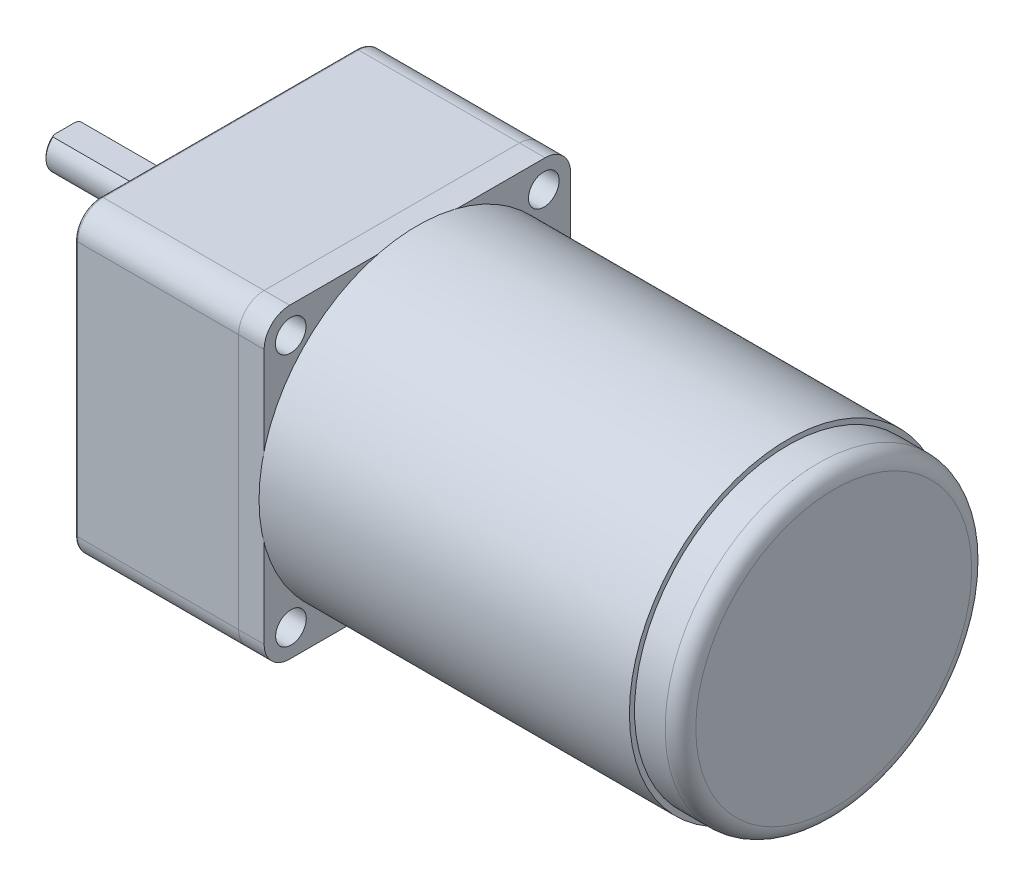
SolidWorks part; units mm, degrees
ref_plane "前视基准面" through (0, 0, 0) normal (0, 0, 1) x (1, 0, 0)
ref_plane "上视基准面" through (0, 0, 0) normal (0, 1, 0) x (1, 0, 0)
ref_plane "右视基准面" through (0, 0, 0) normal (1, 0, 0) x (0, 0, -1)
sketch "草图1" plane through (0, 0, 0) normal (1, 0, 0) x (0, 0, -1)
  line L1 (-25, -30) -> (25, -30)
  line L2 (-30, -25) -> (-30, 25)
  line L3 (-25, 30) -> (25, 30)
  line L4 (30, -25) -> (30, 25)
  line L5 (-30, -30) -> (30, 30) construction
  line L6 (-30, 30) -> (30, -30) construction
  arc A0 (-25, -30) -> (-30, -25) centre (-25, -25) cw
  arc A1 (25, -30) -> (30, -25) centre (25, -25) ccw
  arc A2 (25, 30) -> (30, 25) centre (25, 25) cw
  arc A3 (-30, 25) -> (-25, 30) centre (-25, 25) cw
  point P0 (0, 0)
  dimension "D1" = 5
extrude "凸台-拉伸1" add sketch "草图1" along normal blind 32
sketch "草图2" plane through (32, 0, 0) normal (1, 0, 0) x (0, 0, -1)
  line L0 (25, 30) -> (-25, 30) construction
  line L1 (-25, -30) -> (25, -30)
  line L2 (-30, -25) -> (-30, 25)
  line L3 (-25, 30) -> (25, 30)
  line L4 (30, -25) -> (30, 25)
  line L5 (-30, -30) -> (30, 30) construction
  line L6 (-30, 30) -> (30, -30) construction
  arc A0 (25, 30) -> (30, 25) centre (25, 25) cw
  arc A1 (25, -30) -> (30, -25) centre (25, -25) ccw
  arc A2 (-25, -30) -> (-30, -25) centre (-25, -25) cw
  arc A3 (-30, 25) -> (-25, 30) centre (-25, 25) cw
  point P0 (0, 0)
  dimension "D1" = 5
extrude "凸台-拉伸2" add sketch "草图2" along normal blind 5 separate body
sketch "草图5" plane through (0, 0, 0) normal (-1, 0, 0) x (0, 0, 1)
  circle A0 centre (0, 10) radius 12
extrude "凸台-拉伸5" add sketch "草图5" along normal blind 3 separate body
sketch "草图6" plane through (-3, 0, 0) normal (-1, 0, 0) x (0, 0, 1)
  circle A0 centre (0, 10) radius 4
extrude "凸台-拉伸6" add sketch "草图6" along normal blind 29 separate body
fillet "圆角2" radius 0.5 1 edges at (-3, 10, 12)
sketch "草图7" plane through (-32, 0, 0) normal (-1, 0, 0) x (0, 0, 1)
  line L2 (2.6458, 13) -> (-2.6458, 13)
  arc A0 (2.6458, 13) -> (-2.6458, 13) centre (0, 10) ccw
extrude "切除-拉伸1" cut sketch "草图7" against normal blind 25
chamfer "倒角1" distance 0.3 angle 45 1 edges at (-32, 6, 0)
sketch "草图8" plane through (0, 0, 0) normal (-1, 0, 0) x (0, 0, 1)
  circle A0 centre (0, 0) radius 26.3
extrude "切除-拉伸2" cut sketch "草图8" against normal blind 0.5
fillet "圆角3" radius 0.5 1 edges at (0, 0, 26.3)
fillet "圆角4" radius 0.5 8 edges at (0, -30, 0) (0, -28.5355, -28.5355) (0, 0, -30) (0, 28.5355, -28.5355) (0, 30, 0) (0, 28.5355, 28.5355) (0, 0, 30) (0, -28.5355, 28.5355)
sketch "草图9" plane through (0, 0, 0) normal (-1, 0, 0) x (0, 0, 1)
  point P19 (-24.7487, 24.7487)
  point P20 (24.7487, 24.7487)
  point P21 (24.7487, -24.7487)
  point P22 (-24.7487, -24.7487)
hole_wizard "M4 螺纹孔1" positions "3D草图1" profile "草图10" tap size "M4" standard "GB"
sketch3d "3D草图1"
  point P0 (0, 24.7487, -24.7487)
  point P3 (0, 24.7487, 24.7487)
  point P6 (0, -24.7487, 24.7487)
  point P9 (0, -24.7487, -24.7487)
sketch "草图10" plane through (0, 24.7487, -24.7487) normal (0, 1, 0) x (0, 0, 1)
  line L0 (0, 0) -> (0, 12.9914)
  line L1 (0, 12.9914) -> (1.65, 12)
  line L2 (1.65, 12) -> (1.65, 0)
  line L5 (1.65, 0) -> (0, 0)
  line L10 (0, 12.9914) -> (-1.65, 12) construction
  line L11 (0, -6.35) -> (0, 107.95) construction
  dimension "螺纹孔钻头直径" = 3.3
  dimension "螺纹孔钻头深度" = 12
  dimension "导头角度" = 118
sketch "草图11" plane through (37, 0, 0) normal (1, 0, 0) x (0, 0, -1)
  circle A5 centre (-24.8007, 24.8007) radius 3
  circle A6 centre (24.7487, 24.7487) radius 3
  circle A7 centre (24.7487, -24.7487) radius 3
  circle A8 centre (-24.7487, -24.7487) radius 3
extrude "切除-拉伸3" cut sketch "草图11" against normal blind 25
sketch "草图12" plane through (37, 0, 0) normal (1, 0, 0) x (0, 0, -1)
  circle A0 centre (0, 0) radius 31
extrude "凸台-拉伸7" add sketch "草图12" along normal blind 72.5 separate body
sketch "草图13" plane through (109.5, 0, 0) normal (1, 0, 0) x (0, 0, -1)
  circle A0 centre (0, 0) radius 30
extrude "凸台-拉伸8" add sketch "草图13" along normal blind 9 separate body
fillet "圆角5" radius 3 1 edges at (118.5, 0, -30)
